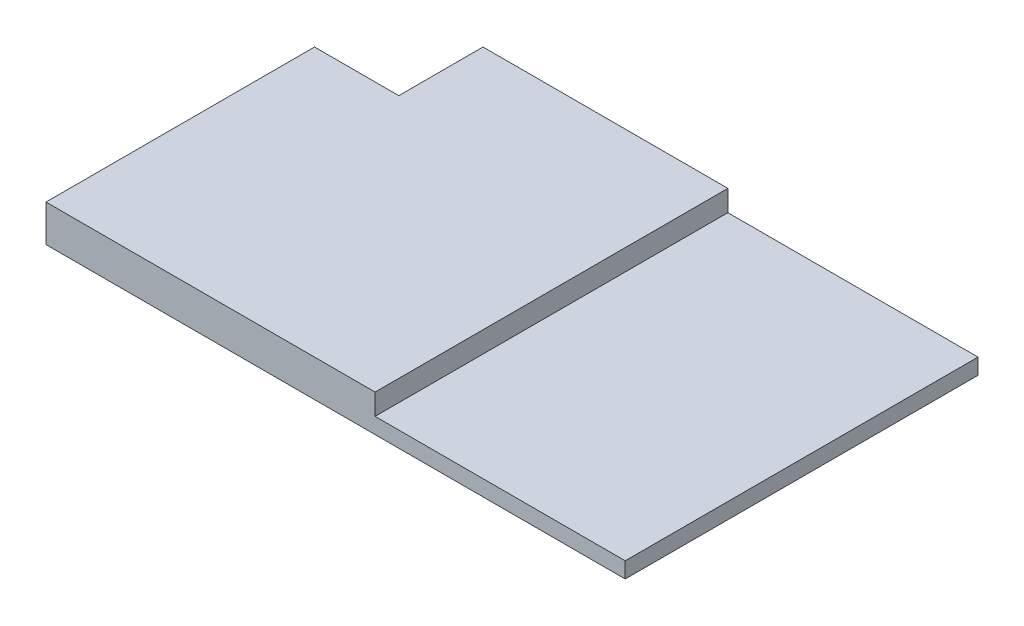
SolidWorks part; units mm, degrees
ref_plane "Front" through (0, 0, 0) normal (0, 0, 1) x (1, 0, 0)
ref_plane "Top" through (0, 0, 0) normal (0, 1, 0) x (1, 0, 0)
ref_plane "Right" through (0, 0, 0) normal (1, 0, 0) x (0, 0, -1)
sketch "Sketch1" plane through (0, 0, 0) normal (0, 1, 0) x (1, 0, 0)
  line L1 (-55, 33.5) -> (55, 33.5)
  line L2 (-55, 33.5) -> (-55, -33.5)
  line L3 (-55, -33.5) -> (55, -33.5)
  line L4 (55, 33.5) -> (55, -33.5)
  line L5 (-55, 33.5) -> (55, -33.5) construction
  line L6 (-55, -33.5) -> (55, 33.5) construction
  point P0 (0, 0)
extrude "Boss-Extrude1" add sketch "Sketch1" along normal blind 7
sketch "Sketch2" plane through (0, 7, 0) normal (0, 1, 0) x (1, 0, 0)
  line L1 (-55, 33.5) -> (-39, 33.5)
  line L2 (-55, 33.5) -> (-55, 17.5)
  line L3 (-55, 17.5) -> (-39, 17.5)
  line L4 (-39, 33.5) -> (-39, 17.5)
extrude "Cut-Extrude1" cut sketch "Sketch2" against normal blind 7
sketch "Sketch3" plane through (0, 7, 0) normal (0, 1, 0) x (1, 0, 0)
  line L0 (-55, -33.5) -> (55, -33.5) construction
  line L1 (55, 33.5) -> (7.5, 33.5)
  line L2 (55, 33.5) -> (55, -33.5)
  line L3 (55, -33.5) -> (7.5, -33.5)
  line L4 (7.5, 33.5) -> (7.5, -33.5)
extrude "Cut-Extrude2" cut sketch "Sketch3" against normal blind 4
sketch "Sketch4" plane through (0, 0, 0) normal (0, -1, 0) x (1, 0, 0)
  line L0 (-55, 33.5) -> (55, 33.5) construction
  line L1 (55, 33.5) -> (-38, 33.5) construction
  line L4 (-38, 0) -> (-38, 5) construction
  line L9 (-38, 0) -> (-38, -5) construction
  line L14 (-38, 5) -> (-42.9999, 5)
  line L15 (-38, 5) -> (-38, -5)
  line L16 (-38, -5) -> (-42.9999, -5)
  line L17 (-42.9999, 5) -> (-42.9999, -5)
extrude "Boss-Extrude2" add sketch "Sketch4" along normal blind 5
